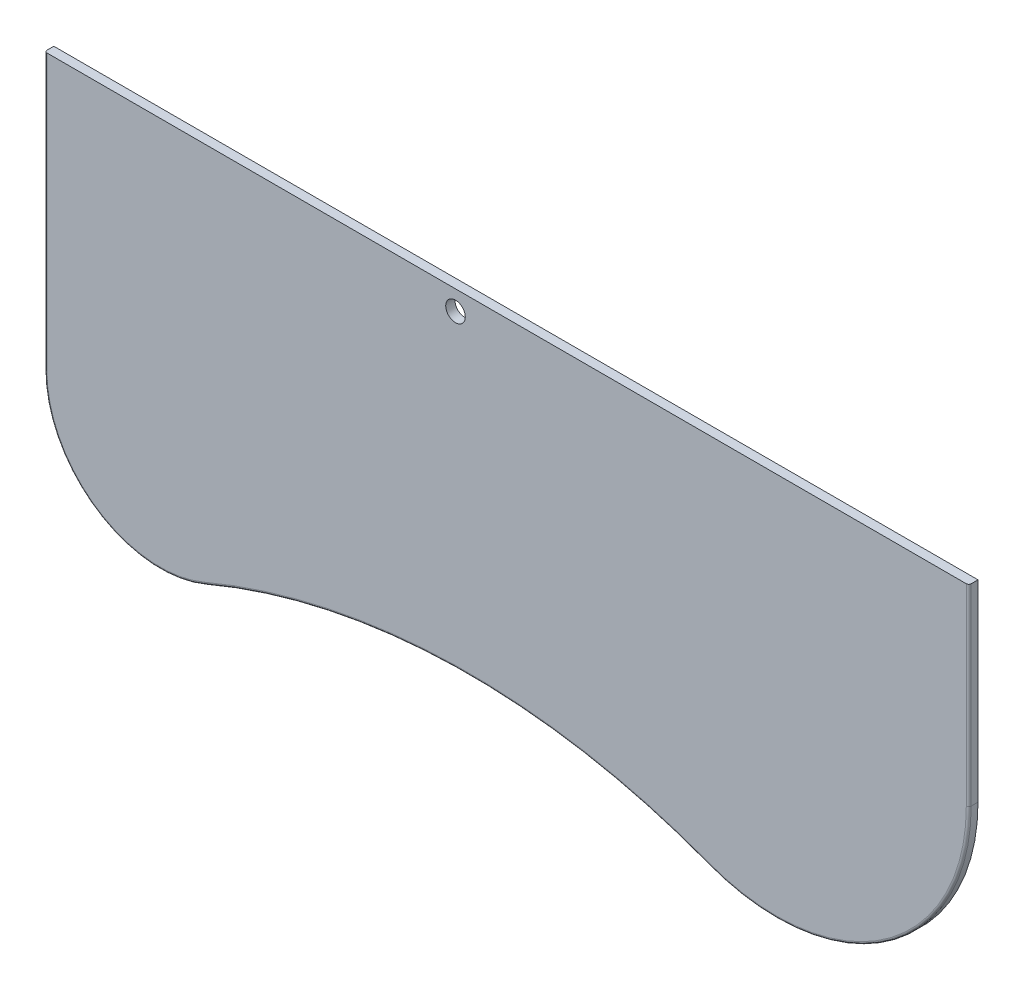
SolidWorks part; units mm, degrees
ref_plane "Front Plane" through (0, 0, 0) normal (0, 0, 1) x (1, 0, 0)
ref_plane "Top Plane" through (0, 0, 0) normal (0, 1, 0) x (1, 0, 0)
ref_plane "Right Plane" through (0, 0, 0) normal (1, 0, 0) x (0, 0, -1)
sketch "Sketch1" plane through (0, 0, 0) normal (0, 0, 1) x (1, 0, 0)
  line L0 (0, 0) -> (0, -357.7738)
  line L1 (1200, -250) -> (1200, 0)
  line L2 (0, 0) -> (1200, 0)
  line L3 (306.5549, -426.4177) -> (672.9714, -426.4177) construction
  line L4 (150, -357.7738) -> (950, -357.7738) construction
  line L5 (950, -250) -> (950, -357.7738) construction
  line L6 (550, -357.7738) -> (550, -2243.0812) construction
  arc A0 (0, -357.7738) -> (208.5932, -495.8565) centre (150, -357.7738) ccw
  arc A1 (208.5932, -495.8565) -> (861.0328, -483.634) centre (550, -1300.4275) cw
  arc A2 (861.0328, -483.634) -> (1200, -250) centre (950, -250) ccw
  point P16 (550, -1300.4275)
  dimension "D2" = 250
  dimension "D3" = 150
  dimension "D5" = 250
  dimension "D6" = 1200
  dimension "D8" = 426.4177
extrude "Boss-Extrude1" add sketch "Sketch1" against normal blind 12
fillet "Fillet1" radius 3.175 5 edges at (1200, -125, 0) (1091.8771, -455.8419, 0) (533.6295, -426.5711, 0) (67.202, -482.8517, 0) (0, -178.8869, 0)
sketch "Sketch2" plane through (0, 0, 0) normal (0, 0, 1) x (1, 0, 0)
  line L0 (533.57, -423.3966) -> (533.57, 0) construction
  line L1 (1196.825, 0) -> (3.175, 0) construction
  arc A0 (862.1627, -480.6668) -> (207.353, -492.9338) centre (550, -1300.4275) ccw construction
  circle A1 centre (533.57, -25.4) radius 12.7
  dimension "D1" = 25.4
  dimension "D2" = 25.4
extrude "Cut-Extrude1" cut sketch "Sketch2" against normal through all
